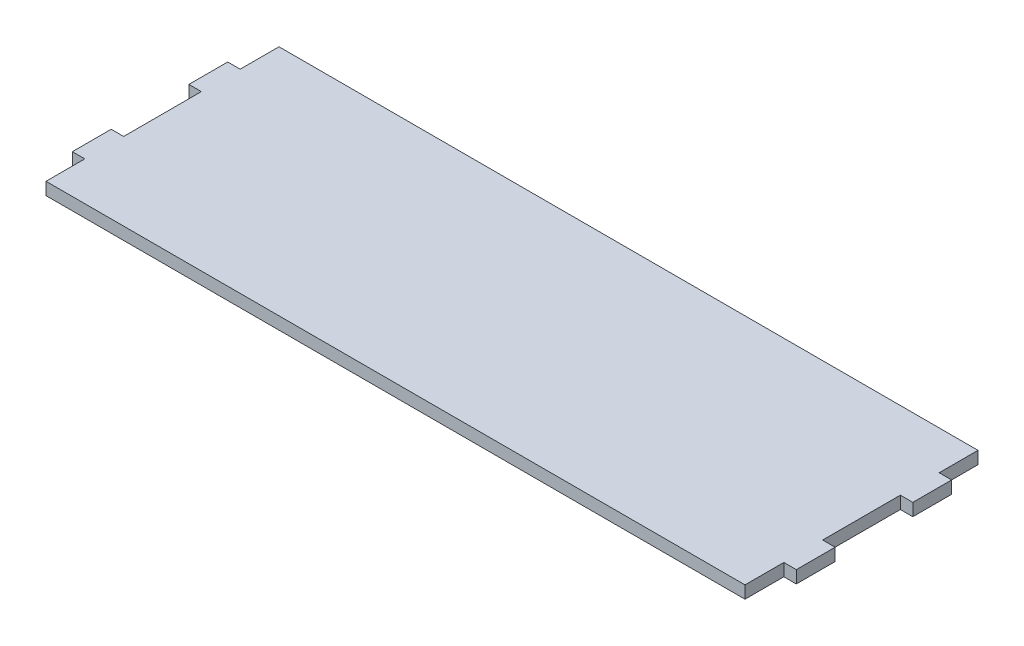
SolidWorks part; units mm, degrees
ref_plane "Front Plane" through (0, 0, 0) normal (0, 0, 1) x (1, 0, 0)
ref_plane "Top Plane" through (0, 0, 0) normal (0, 1, 0) x (1, 0, 0)
ref_plane "Right Plane" through (0, 0, 0) normal (1, 0, 0) x (0, 0, -1)
sketch "Sketch1" plane through (0, 0, 0) normal (0, 1, 0) x (1, 0, 0)
  line L0 (397.828, 260.1234) -> (397.828, -6.9187) construction
  line L1 (-59.372, 260.1234) -> (855.028, 260.1234)
  line L2 (-59.372, 260.1234) -> (-59.372, 209.3234)
  line L3 (-59.372, -44.6766) -> (855.028, -44.6766)
  line L4 (-59.372, 158.5234) -> (-59.372, 56.9234)
  line L5 (-59.372, 6.1234) -> (-59.372, -44.6766)
  line L6 (855.028, 6.1234) -> (871.328, 6.1234)
  line L7 (-59.372, 209.3234) -> (-75.672, 209.3234)
  line L8 (-75.672, 209.3234) -> (-75.672, 158.5234)
  line L9 (855.028, 260.1234) -> (855.028, 209.3234)
  line L10 (855.028, 158.5234) -> (855.028, 56.9234)
  line L11 (-75.672, 158.5234) -> (-59.372, 158.5234)
  line L12 (871.328, 6.1234) -> (871.328, 56.9234)
  line L13 (-59.372, 6.1234) -> (-75.672, 6.1234)
  line L14 (-75.672, 6.1234) -> (-75.672, 56.9234)
  line L15 (-75.672, 56.9234) -> (-59.372, 56.9234)
  line L16 (871.328, 56.9234) -> (855.028, 56.9234)
  line L17 (871.328, 158.5234) -> (855.028, 158.5234)
  line L18 (871.328, 209.3234) -> (871.328, 158.5234)
  line L19 (855.028, 209.3234) -> (871.328, 209.3234)
  line L20 (855.028, 6.1234) -> (855.028, -44.6766)
  point P4 (-59.372, 234.7234)
extrude "Boss-Extrude1" add sketch "Sketch1" along normal blind 16.3
